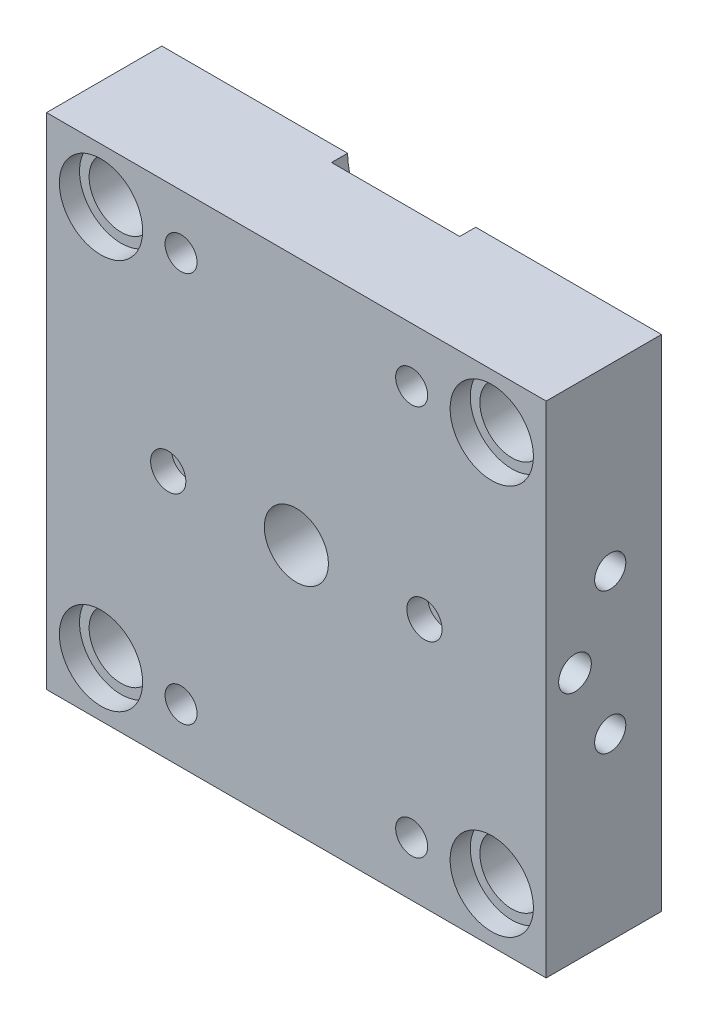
SolidWorks part; units mm, degrees
ref_plane "Plan de face" through (0, 0, 0) normal (0, 0, 1) x (1, 0, 0)
ref_plane "Plan de dessus" through (0, 0, 0) normal (0, 1, 0) x (1, 0, 0)
ref_plane "Plan de droite" through (0, 0, 0) normal (1, 0, 0) x (0, 0, -1)
sketch "Esquisse1" plane through (0, 0, 0) normal (0, 0, 1) x (1, 0, 0)
  line L1 (-78, 78) -> (78, 78)
  line L2 (-78, 78) -> (-78, -78)
  line L3 (-78, -78) -> (78, -78)
  line L4 (78, 78) -> (78, -78)
  point P4 (0, 78)
  point P6 (-78, 0)
  dimension "D1" = 156
  dimension "D2" = 156
extrude "Extrusion1" add sketch "Esquisse1" along normal blind 36
sketch "Esquisse2" plane through (0, 0, 0) normal (0, 0, 1) x (1, 0, 0)
  circle A0 centre (-61, 61) radius 10
  dimension "D1" = 20
  dimension "D3" = 61
  dimension "D2" = 61
extrude "Enlèv. mat.-Extru.2" cut sketch "Esquisse2" along normal through all
sketch "Esquisse3" plane through (0, 0, 36) normal (0, 0, 1) x (1, 0, 0)
  circle A0 centre (-61, 61) radius 13
  dimension "D1" = 26
extrude "Enlèv. mat.-Extru.3" cut sketch "Esquisse3" against normal blind 6.3
hole_wizard "Trou taraudé M10x1.51" positions "Esquisse7" profile "Esquisse6" tap size "M10x1.5" standard "Ansi Métrique"
sketch "Esquisse7" plane through (0, 0, 36) normal (0, 0, 1) x (1, 0, 0)
  point P0 (-36, 61)
  dimension "D1" = 61
  dimension "D2" = 36
sketch "Esquisse6" plane through (-36, 61, 36) normal (1, 0, 0) x (0, -1, 0)
  line L0 (0, 0) -> (0, 22.5537)
  line L1 (0, 22.5537) -> (4.25, 20)
  line L2 (4.25, 20) -> (4.25, 15)
  line L3 (4.25, 15) -> (5, 15)
  line L4 (5, 15) -> (5, 0)
  line L5 (5, 0) -> (0, 0)
  line L10 (0, 22.5537) -> (-4.25, 20) construction
  line L11 (0, -6.35) -> (0, 107.95) construction
  dimension "Diamètre du trou pour taraudage" = 8.5
  dimension "Profondeur du trou pour taraudage" = 20
  dimension "Diamètre principal du filetage" = 10
  dimension "Profondeur du filetage" = 15
  dimension "Angle de pointe" = 118
mirror "Symétrie1" about plane through (0, 0, 0) normal (1, 0, 0) of "Enlèv. mat.-Extru.3", "Enlèv. mat.-Extru.2", "Trou taraudé M10x1.51"
mirror "Symétrie2" about plane through (0, 0, 0) normal (0, 1, 0) of "Symétrie1", "Enlèv. mat.-Extru.2", "Enlèv. mat.-Extru.3", "Trou taraudé M10x1.51"
sketch "Esquisse9" plane through (0, 0, 0) normal (0, 0, -1) x (-1, 0, 0)
  line L0 (-78, 78) -> (78, 78) construction
  line L1 (78, -78) -> (-78, -78) construction
  line L2 (-20, 78) -> (20, 78)
  line L3 (-20, -78) -> (20, -78)
  arc A0 (-20, 78) -> (20, 78) centre (0, 78) ccw
  arc A1 (20, -78) -> (-20, -78) centre (0, -78) ccw
  dimension "D1" = 20
  dimension "D2" = 20
extrude "passage pinces" cut sketch "Esquisse9" against normal blind 5
hole_wizard "Trou taraudé M12x1.751" positions "Esquisse16" profile "Esquisse15" tap size "M12x1.75" standard "Ansi Métrique"
sketch "Esquisse16" plane through (78, 0, 0) normal (1, 0, 0) x (0, 0, -1)
  line L0 (0, -78) -> (0, 78) construction
  point P0 (-27, 0)
  dimension "D1" = 27
sketch "Esquisse15" plane through (78, 0, 27) normal (0, 1, 0) x (0, 0, -1)
  line L0 (0, 0) -> (0, 28.0644)
  line L1 (0, 28.0644) -> (5.1, 25)
  line L2 (5.1, 25) -> (5.1, 0)
  line L5 (5.1, 0) -> (0, 0)
  line L10 (0, 28.0644) -> (-5.1, 25) construction
  line L11 (0, -6.35) -> (0, 107.95) construction
  dimension "Diamètre du trou pour taraudage" = 10.2
  dimension "Profondeur du trou pour taraudage" = 25
  dimension "Angle de pointe" = 118
hole_wizard "Trou taraudé 1/8 Rc1" positions "Esquisse18" profile "Esquisse17" size "1/8" standard "ISO"
sketch "Esquisse18" plane through (-78, 0, 0) normal (-1, 0, 0) x (0, 0, 1)
  line L0 (0, 78) -> (0, -78) construction
  point P0 (16, 22)
  point P2 (16, -22)
  point P5 (0, 0)
  dimension "D1" = 44
  dimension "D2" = 22
  dimension "D3" = 16
sketch "Esquisse17" plane through (-78, 22, 16) normal (0, 1, 0) x (0, 0, 1)
  line L0 (0, 0) -> (0, 80.3734)
  line L1 (3.95, 78) -> (0, 80.3734)
  line L2 (-3.95, 78) -> (0, 80.3734) construction
  line L3 (3.95, 78) -> (3.95, 7.4)
  line L4 (3.95, 7.4) -> (4.633, 7.4)
  line L5 (4.633, 7.4) -> (4.864, 0)
  line L6 (-4.633, 7.4) -> (-4.864, 0) construction
  line L7 (4.864, 0) -> (0, 0)
  line L8 (0, -6.35) -> (0, 107.95) construction
  line L11 (-3.95, 7.4) -> (-4.633, 7.4) construction
  dimension "Diamètre du trou pour taraudage" = 7.9
  dimension "Profondeur du trou pour taraudage" = 78
  dimension "Diamètre du filetage" = 9.728
  dimension "Angle de filetage" = 3.576
  dimension "Profondeur du filetage" = 7.4
  dimension "Angle de pointe" = 118
mirror "Symétrie3" about plane through (0, 0, 0) normal (1, 0, 0) of "Trou taraudé 1/8 Rc1"
sketch "Esquisse19" plane through (0, 0, 0) normal (0, 0, -1) x (-1, 0, 0)
  circle A0 centre (0, 0) radius 10
  dimension "D1" = 20
extrude "Enlèv. mat.-Extru.4" cut sketch "Esquisse19" against normal through all
sketch "Esquisse20" plane through (0, 0, 0) normal (0, 0, -1) x (-1, 0, 0)
  circle A0 centre (40, 0) radius 6.5 construction
  circle A1 centre (40, 0) radius 6.5
extrude "Enlèv. mat.-Extru.5" cut sketch "Esquisse20" against normal blind 15
sketch "Esquisse21" plane through (0, 0, 15) normal (0, 0, -1) x (-1, 0, 0)
  circle A0 centre (40, 0) radius 3.25
  dimension "D1" = 6.5
extrude "Enlèv. mat.-Extru.6" cut sketch "Esquisse21" against normal through all
sketch "Esquisse22" plane through (0, 0, 36) normal (0, 0, 1) x (1, 0, 0)
  circle A0 centre (-40, 0) radius 5.5
  dimension "D1" = 11
extrude "Enlèv. mat.-Extru.7" cut sketch "Esquisse22" against normal blind 6.5
mirror "Symétrie4" about plane through (0, 0, 0) normal (1, 0, 0) of "Enlèv. mat.-Extru.7", "Enlèv. mat.-Extru.6", "Enlèv. mat.-Extru.5"
